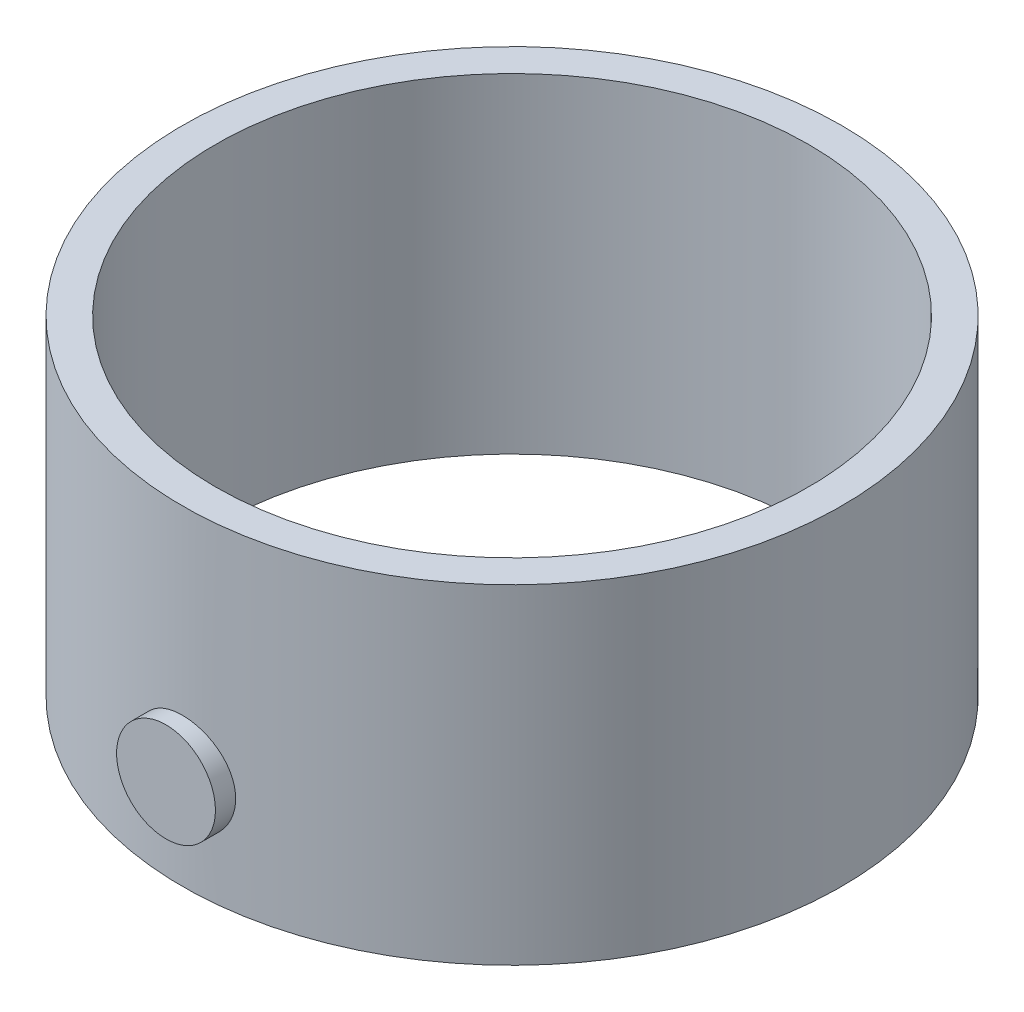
SolidWorks part; units mm, degrees
ref_plane "Front Plane" through (0, 0, 0) normal (0, 0, 1) x (1, 0, 0)
ref_plane "Top Plane" through (0, 0, 0) normal (0, 1, 0) x (1, 0, 0)
ref_plane "Right Plane" through (0, 0, 0) normal (1, 0, 0) x (0, 0, -1)
sketch "Sketch1" plane through (0, 0, 0) normal (0, 0, 1) x (1, 0, 0)
  line L1 (0, 0) -> (254, 0)
  line L2 (0, 0) -> (0, 254)
  line L3 (0, 254) -> (254, 254)
  line L4 (254, 0) -> (254, 254)
  dimension "D1" = 254
  dimension "D2" = 254
revolve "Revolve1" add sketch "Sketch1" angle 360 about L2
shell "Shell1" thickness 25.4
ref_plane "Plane1" through (0, 0, 266.7) normal (0, 0, 1) x (1, 0, 0)
sketch "Sketch2" plane through (0, 0, 266.7) normal (0, 0, 1) x (1, 0, 0)
  line L0 (0, 76.2) -> (0, 0) construction
  circle A0 centre (0, 76.2) radius 38.1
  dimension "D1" = 76.2
  dimension "D2" = 76.2
extrude "Boss-Extrude1" add sketch "Sketch2" against normal up to next
